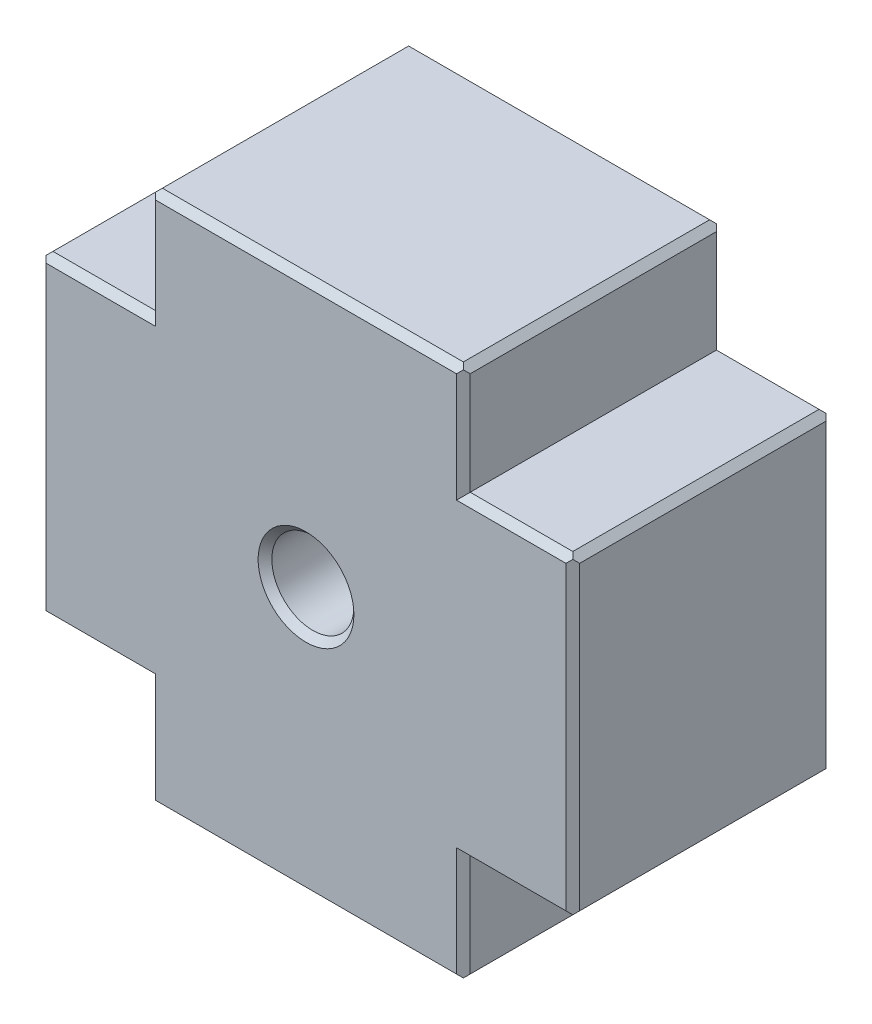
SolidWorks part; units mm, degrees
ref_plane "前视基准面" through (0, 0, 0) normal (0, 0, 1) x (1, 0, 0)
ref_plane "上视基准面" through (0, 0, 0) normal (0, 1, 0) x (1, 0, 0)
ref_plane "右视基准面" through (0, 0, 0) normal (1, 0, 0) x (0, 0, -1)
sketch "草图1" plane through (0, 0, 0) normal (0, 0, 1) x (1, 0, 0)
  line L0 (-15.5, 15.5) -> (15.5, 15.5) construction
  line L1 (19.5, -19.5) -> (-19.5, -19.5)
  line L2 (19.5, -19.5) -> (19.5, 19.5)
  line L3 (19.5, 19.5) -> (-19.5, 19.5)
  line L4 (-19.5, -19.5) -> (-19.5, 19.5)
  line L5 (19.5, -19.5) -> (-19.5, 19.5) construction
  line L6 (19.5, 19.5) -> (-19.5, -19.5) construction
  line L7 (-25.2844, 0) -> (27.579, 0) construction
  line L8 (0, 27.3359) -> (0, -23.1664) construction
  line L9 (-15.5, -15.5) -> (15.5, -15.5) construction
  line L10 (-11.5, 11.5) -> (-19.5, 11.5)
  line L11 (-11.5, 11.5) -> (-11.5, 19.5)
  line L12 (-15.5, 15.5) -> (-15.5, 11.5) construction
  line L13 (11.5, 11.5) -> (19.5, 11.5)
  line L14 (11.5, 11.5) -> (11.5, 19.5)
  line L15 (11.5, -11.5) -> (19.5, -11.5)
  line L16 (11.5, -11.5) -> (11.5, -19.5)
  line L17 (-11.5, -11.5) -> (-19.5, -11.5)
  line L18 (-11.5, -11.5) -> (-11.5, -19.5)
  point P0 (0, 0)
  dimension "D1" = 39
  dimension "D2" = 39
  dimension "D3" = 31
extrude "凸台-拉伸1" add sketch "草图1" along normal blind 19 contours L17 L18 L1 L16 L15 L2 L13 L14 L3 L11 L10 L4
chamfer "倒角1" distance 0.5 angle 45 24 edges at (-11.5, -15.5, 0) (0, -19.5, 0) (11.5, -15.5, 0) (15.5, -11.5, 0) (19.5, 0, 0) (15.5, 11.5, 0) (11.5, 15.5, 0) (0, 19.5, 0) (-11.5, 15.5, 0) (-15.5, 11.5, 0) (-19.5, 0, 0) (-15.5, -11.5, 0) (-19.5, 0, 19) (-15.5, 11.5, 19) (-11.5, 15.5, 19) (0, 19.5, 19) (11.5, 15.5, 19) (15.5, 11.5, 19) (19.5, 0, 19) (15.5, -11.5, 19) (11.5, -15.5, 19) (0, -19.5, 19) (-11.5, -15.5, 19) (-15.5, -11.5, 19)
chamfer "倒角2" distance 0.5 angle 45 8 edges at (-19.5, 11.5, 9.5) (-19.5, -11.5, 9.5) (-11.5, -19.5, 9.5) (11.5, -19.5, 9.5) (19.5, -11.5, 9.5) (19.5, 11.5, 9.5) (11.5, 19.5, 9.5) (-11.5, 19.5, 9.5)
sketch "草图2" plane through (0, 0, 0) normal (0, 0, -1) x (-1, 0, 0)
  circle A0 centre (0, 0) radius 3
  dimension "D1" = 6
extrude "切除-拉伸1" cut sketch "草图2" against normal through all
chamfer "倒角3" distance 0.5 angle 45 2 edges at (-3, 0, 19) (-3, 0, 0)
